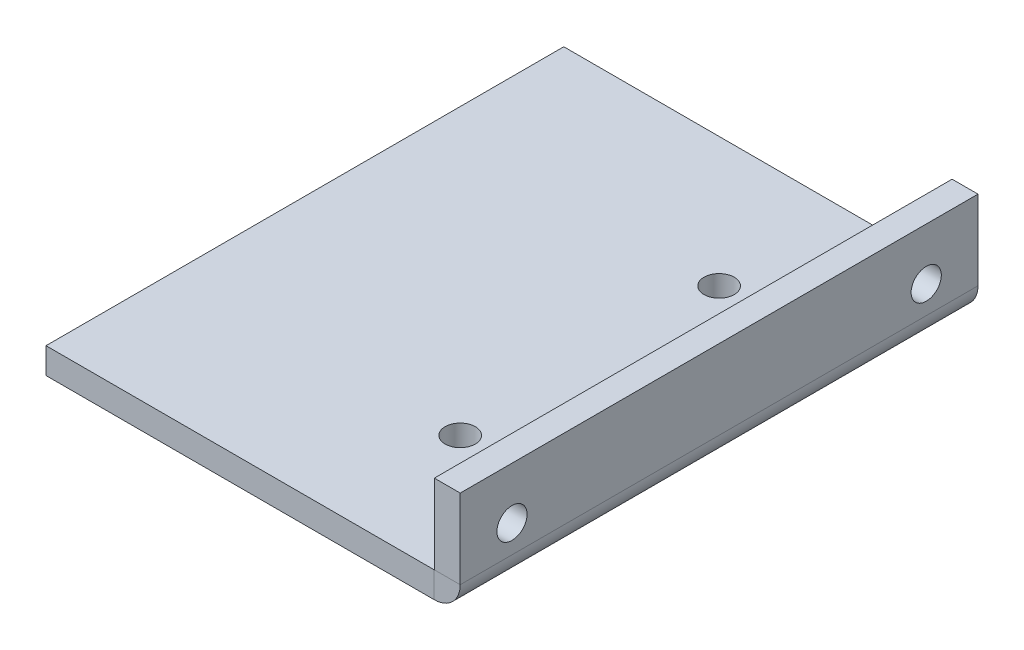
SolidWorks part; units mm, degrees
ref_plane "Front" through (0, 0, 0) normal (0, 0, 1) x (1, 0, 0)
ref_plane "Top" through (0, 0, 0) normal (0, 1, 0) x (1, 0, 0)
ref_plane "Right" through (0, 0, 0) normal (1, 0, 0) x (0, 0, -1)
sketch "Sketch1" plane through (0, 0, 0) normal (0, 1, 0) x (1, 0, 0)
  line L1 (0, 0) -> (57, 0)
  line L2 (0, 0) -> (0, 60)
  line L3 (0, 60) -> (57, 60)
  line L4 (57, 0) -> (57, 60)
  circle A0 centre (33, 45) radius 1.75
  circle A1 centre (33, 15) radius 1.75
  circle A2 centre (51, 54) radius 1.75
  circle A3 centre (51, 6) radius 1.75
sheet metal parameters "Sheet-Metal1" thickness 3 parameters "D1"=0.01
base flange "Base-Flange1" sketch "Sketch1" thickness 3 reverse thickness direction yes parameters "D1"=0.01
sketch "Sketch3" plane through (0, 3, 0) normal (0, 1, 0) x (-1, 0, 0)
  line L1 (-45, -60) -> (-45, 0)
sketched bend "Sketched Bend1" parameters "D1"=0.01
bend "SketchBend1" bend radius 0.01 bend angle 90 parameters "D5"=1
flat pattern "Flat-Pattern1"
sketch "Bend-Lines1" plane through (0, 3, 0) normal (0, 1, 0) x (-1, 0, 0)
  line L0 (-46.3951, -60) -> (-46.3951, 0) construction
bend of the flat pattern "Flatten-<SketchBend1>1"
